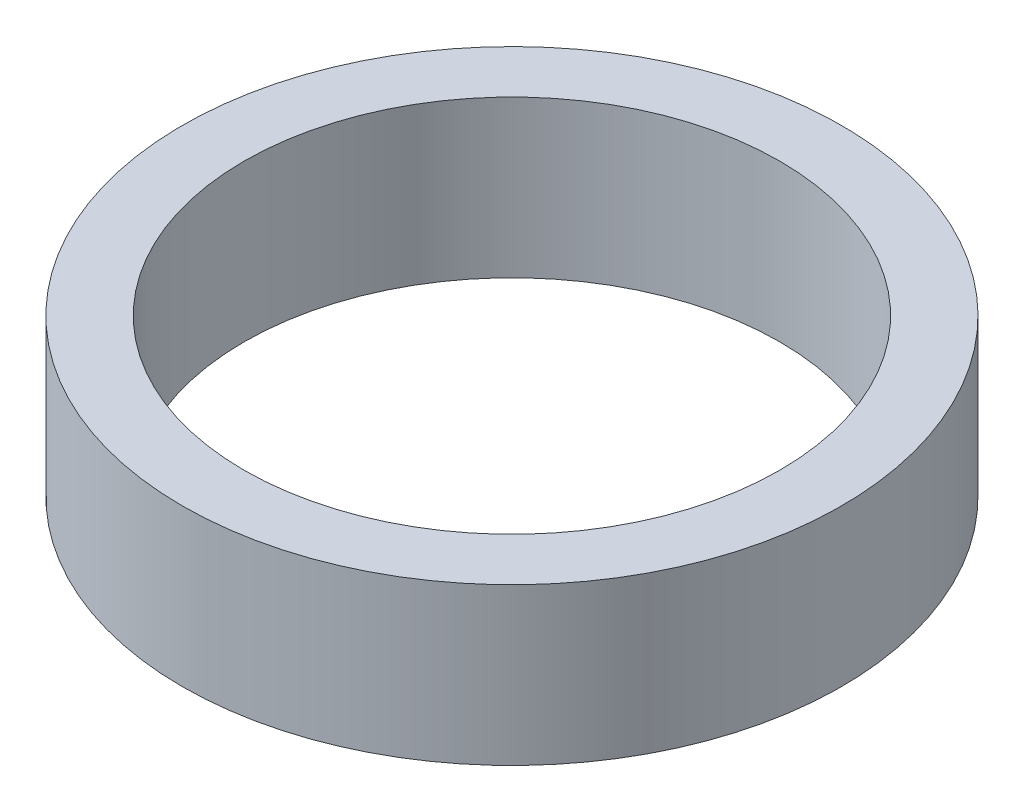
SolidWorks part; units mm, degrees
ref_plane "Alzado" through (0, 0, 0) normal (0, 0, 1) x (1, 0, 0)
ref_plane "Planta" through (0, 0, 0) normal (0, 1, 0) x (1, 0, 0)
ref_plane "Vista lateral" through (0, 0, 0) normal (1, 0, 0) x (0, 0, -1)
sketch "Croquis1" plane through (0, 0, 0) normal (0, 1, 0) x (1, 0, 0)
  circle A0 centre (0, 0) radius 40
  dimension "D1" = 80
extrude "Saliente-Extruir1" add sketch "Croquis1" along normal blind 19
sketch "Croquis2" plane through (0, 19, 0) normal (0, 1, 0) x (1, 0, 0)
  circle A0 centre (0, 0) radius 32.5
  dimension "D1" = 65
extrude "Cortar-Extruir1" cut sketch "Croquis2" against normal blind 19
